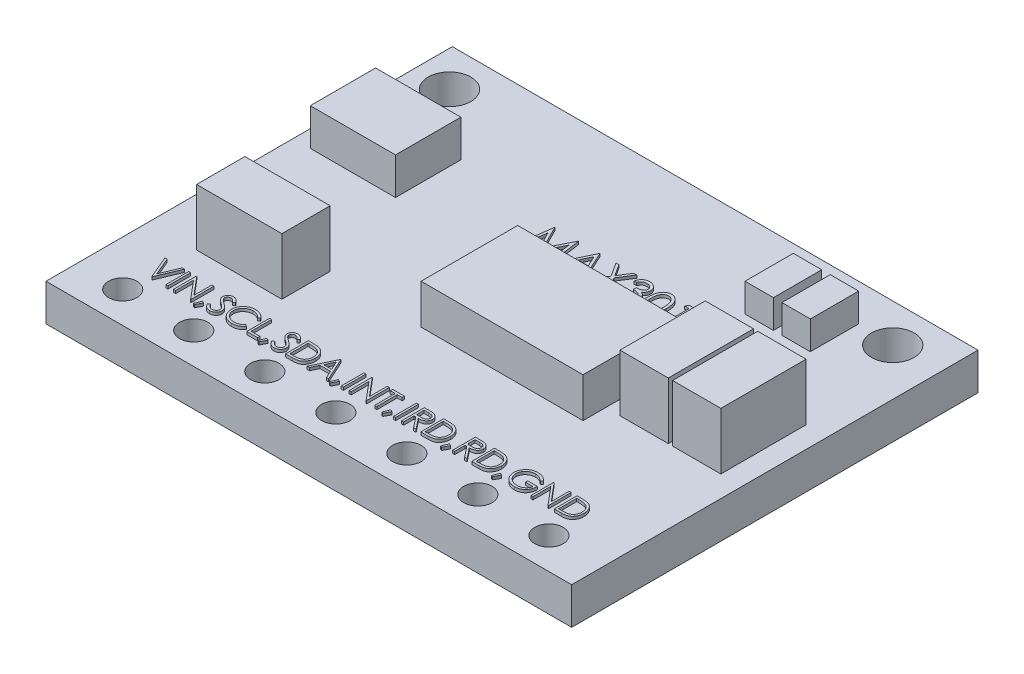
SolidWorks part; units mm, degrees
ref_plane "前基準面" through (0, 0, 0) normal (0, 0, 1) x (1, 0, 0)
ref_plane "上基準面" through (0, 0, 0) normal (0, 1, 0) x (1, 0, 0)
ref_plane "右基準面" through (0, 0, 0) normal (1, 0, 0) x (0, 0, -1)
sketch "Sketch1" plane through (0, 0, 0) normal (0, 1, 0) x (1, 0, 0)
  line L1 (0, 0) -> (18.5, 0)
  line L2 (0, 0) -> (0, 14.3)
  line L3 (0, 14.3) -> (18.5, 14.3)
  line L4 (18.5, 0) -> (18.5, 14.3)
  dimension "D1" = 18.5
  dimension "D2" = 14.3
extrude "base" add sketch "Sketch1" along normal blind 1.3
sketch "Sketch2" plane through (0, 1.3, 0) normal (0, 1, 0) x (1, 0, 0)
  line L0 (1.1, 2.6925) -> (1.1, 0.6) construction
  line L1 (1.1, 0.6) -> (3.0984, 0.6) construction
  line L2 (0, 14.3) -> (0, 0) construction
  line L3 (0, 0) -> (18.5, 0) construction
  circle A0 centre (1.6, 1.1) radius 0.5
  dimension "D1" = 1
  dimension "D2" = 1.1
  dimension "D3" = 0.6
extrude "electrodes1" cut sketch "Sketch2" against normal through all
pattern_linear "electrodesN" count 7 spacing 2.5 along (1, 0, 0) of "electrodes1"
sketch "Sketch3" plane through (0, 1.3, 0) normal (0, 1, 0) x (1, 0, 0)
  line L0 (3.9938, 13.7) -> (0.5, 13.7) construction
  line L1 (0.5, 13.7) -> (0.5, 10.9717) construction
  line L2 (0, 14.3) -> (0, 0) construction
  line L3 (18.5, 14.3) -> (0, 14.3) construction
  circle A0 centre (1.25, 12.95) radius 0.75
  circle A1 centre (16.85, 12.95) radius 0.75
  dimension "D1" = 1.5
  dimension "D4" = 15.6
  dimension "D2" = 0.5
  dimension "D3" = 0.6
extrude "fixingHole" cut sketch "Sketch3" against normal through all
sketch "Sketch4" plane through (0, 1.3, 0) normal (0, 1, 0) x (1, 0, 0)
  line L0 (18.5, 0) -> (18.5, 14.3) construction
  line L1 (14.2, 9) -> (15.9, 9)
  line L2 (14.2, 9) -> (14.2, 6)
  line L3 (14.2, 6) -> (15.9, 6)
  line L4 (15.9, 9) -> (15.9, 6)
  line L5 (16.05, 9) -> (17.75, 9)
  line L6 (16.05, 9) -> (16.05, 6)
  line L7 (16.05, 6) -> (17.75, 6)
  line L8 (17.75, 9) -> (17.75, 6)
  line L9 (1.7, 3.6) -> (4.7, 3.6)
  line L10 (1.7, 3.6) -> (1.7, 5.3)
  line L11 (1.7, 5.3) -> (4.7, 5.3)
  line L12 (4.7, 3.6) -> (4.7, 5.3)
  line L13 (0, 0) -> (18.5, 0) construction
  line L14 (0, 14.3) -> (0, 0) construction
  dimension "D1" = 3
  dimension "D2" = 1.7
  dimension "D3" = 4.3
  dimension "D4" = 3.55
  dimension "D5" = 9
  dimension "D6" = 4.7
  dimension "D7" = 5.3
extrude "component1" add sketch "Sketch4" along normal blind 2
sketch "Sketch5" plane through (0, 1.3, 0) normal (0, 1, 0) x (1, 0, 0)
  line L0 (0, 0) -> (18.5, 0) construction
  line L1 (8, 8.6) -> (13.7, 8.6)
  line L2 (8, 8.6) -> (8, 5.2)
  line L3 (8, 5.2) -> (13.7, 5.2)
  line L4 (13.7, 8.6) -> (13.7, 5.2)
  line L5 (18.5, 0) -> (18.5, 14.3) construction
  dimension "D1" = 5.7
  dimension "D2" = 3.4
  dimension "D3" = 8.6
  dimension "D4" = 10.5
extrude "sensor" add sketch "Sketch5" along normal blind 1.4
sketch "Sketch6" plane through (0, 1.3, 0) normal (0, 1, 0) x (1, 0, 0)
  line L0 (18.5, 0) -> (18.5, 14.3) construction
  line L1 (14.6, 13) -> (15.6, 13)
  line L2 (14.6, 13) -> (14.6, 11.3)
  line L3 (14.6, 11.3) -> (15.6, 11.3)
  line L4 (15.6, 13) -> (15.6, 11.3)
  line L5 (14.3, 13) -> (13.3, 13)
  line L6 (14.3, 13) -> (14.3, 11.3)
  line L7 (14.3, 11.3) -> (13.3, 11.3)
  line L8 (13.3, 13) -> (13.3, 11.3)
  line L9 (18.5, 14.3) -> (0, 14.3) construction
  dimension "D1" = 1
  dimension "D2" = 1.7
  dimension "D3" = 5.2
  dimension "D4" = 3
  dimension "D5" = 2.3
extrude "component2" add sketch "Sketch6" along normal blind 1
sketch "Sketch7" plane through (0, 1.3, 0) normal (0, 1, 0) x (1, 0, 0)
  line L0 (0, 14.3) -> (0, 0) construction
  line L1 (0.6, 11) -> (3.6, 11)
  line L2 (0.6, 11) -> (0.6, 8.7)
  line L3 (0.6, 8.7) -> (3.6, 8.7)
  line L4 (3.6, 11) -> (3.6, 8.7)
  line L5 (0, 0) -> (18.5, 0) construction
  dimension "D1" = 3
  dimension "D2" = 2.3
  dimension "D3" = 3.6
  dimension "D4" = 11
extrude "component3" add sketch "Sketch7" along normal blind 1.3
sketch "Sketch8" plane through (0, 1.3, 0) normal (0, 1, 0) x (1, 0, 0)
  text T0 "MAX30102" font "Century Gothic" height 1
  text T1 "VIN,SCL,SDA,INT,IRD,RD,GND" font "Century Gothic" height 0.8
extrude "text" add sketch "Sketch8" along normal blind 0.1
